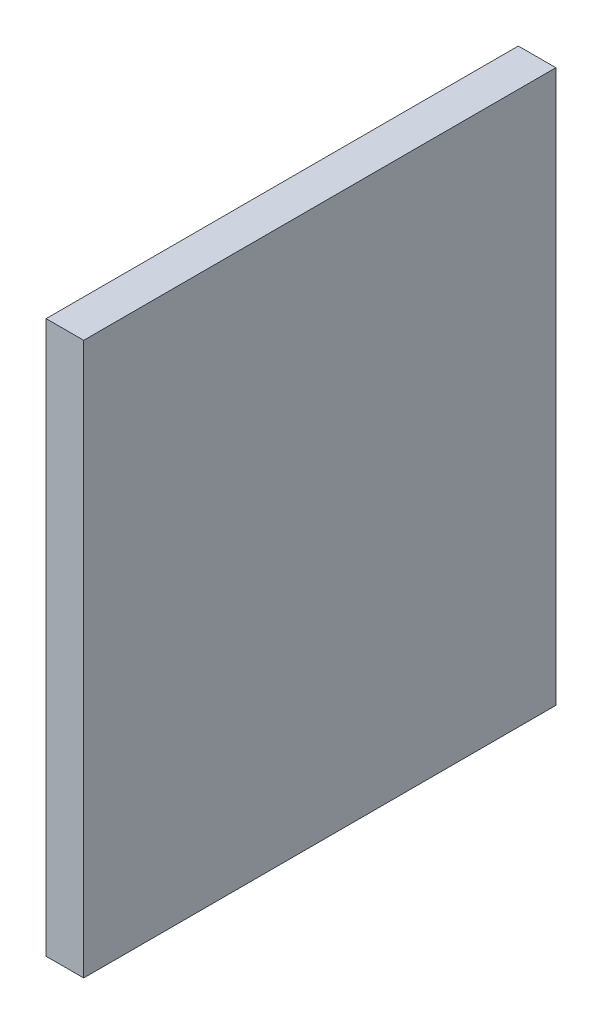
SolidWorks part; units mm, degrees
ref_plane "Front Plane" through (0, 0, 0) normal (0, 0, 1) x (1, 0, 0)
ref_plane "Top Plane" through (0, 0, 0) normal (0, 1, 0) x (1, 0, 0)
ref_plane "Right Plane" through (0, 0, 0) normal (1, 0, 0) x (0, 0, -1)
sketch "Sketch1" plane through (0, 0, 0) normal (1, 0, 0) x (0, 0, -1)
  line L1 (-100.55, 117.6) -> (100.55, 117.6)
  line L2 (-100.55, 117.6) -> (-100.55, -117.6)
  line L3 (-100.55, -117.6) -> (100.55, -117.6)
  line L4 (100.55, 117.6) -> (100.55, -117.6)
  line L5 (-100.55, 117.6) -> (100.55, -117.6) construction
  line L6 (-100.55, -117.6) -> (100.55, 117.6) construction
  point P0 (0, 0)
  dimension "D1" = 201.1
  dimension "D2" = 235.2
extrude "Boss-Extrude1" add sketch "Sketch1" along normal blind 16
chamfer "Chamfer3" [suppressed] distance 12 angle 45
